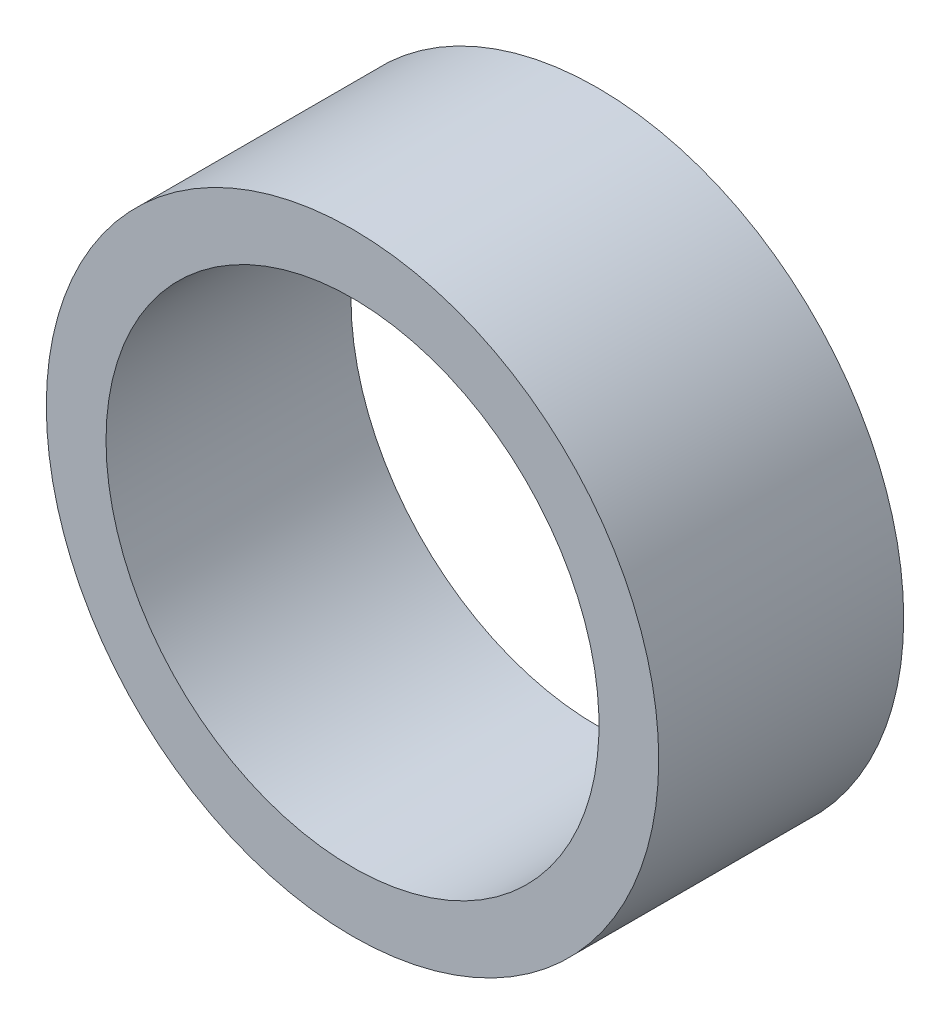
SolidWorks part; units mm, degrees
ref_plane "Front" through (0, 0, 0) normal (0, 0, 1) x (1, 0, 0)
ref_plane "Top" through (0, 0, 0) normal (0, 1, 0) x (1, 0, 0)
ref_plane "Right" through (0, 0, 0) normal (1, 0, 0) x (0, 0, -1)
sketch "Logo3_Revol_Axis" plane through (0, 0, 0) normal (0, 1, 0) x (1, 0, 0)
  line L0 (0, -30.1653) -> (0, 30.1653) construction
sketch "Logo3_bib1" plane through (0, 0, 0) normal (0, -1, 0) x (-1, 0, 0)
  line L0 (7.9375, 0) -> (6.3895, 0)
  line L1 (6.3895, 0) -> (6.3895, -6.35)
  line L2 (6.3895, -6.35) -> (7.9375, -6.35)
  line L3 (7.1635, 0) -> (7.1635, -6.35) construction
  line L4 (7.9375, -6.35) -> (7.9375, 0)
  line L5 (7.9375, -3.175) -> (6.3895, -3.175) construction
  line L10 (0, 38.9764) -> (0, -41.3764) construction
  point P11 (6.3895, 0)
  point P15 (6.3895, -6.35)
revolve "Revolve1" add sketch "Logo3_bib1" angle 360 about L10
equation "\"D2@Logo3_bib1\"=\"logo3_l1@Logo3_bib1\"/2"
equation "\"D3@Logo3_bib1\"=(\"logo3_d1@Logo3_bib1\"-\"logo3_d_in@Logo3_bib1\")/4"
